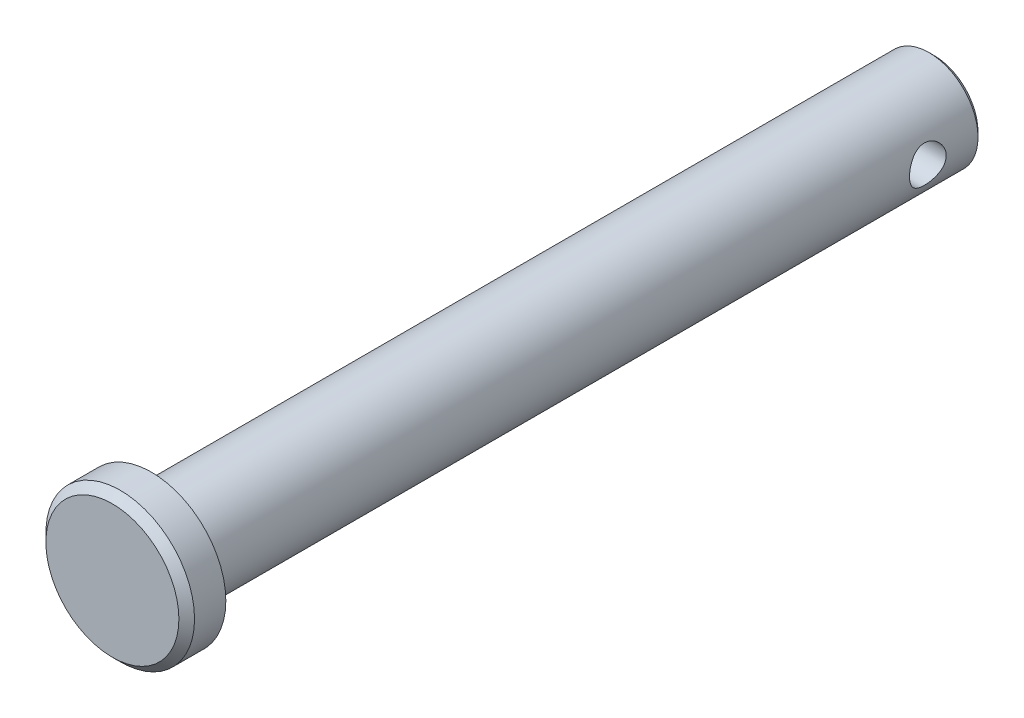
SolidWorks part; units mm, degrees
ref_plane "Front" through (0, 0, 0) normal (0, 0, 1) x (1, 0, 0)
ref_plane "Top" through (0, 0, 0) normal (0, 1, 0) x (1, 0, 0)
ref_plane "Right" through (0, 0, 0) normal (1, 0, 0) x (0, 0, -1)
sketch "Sketch1" plane through (0, 0, 0) normal (0, 0, 1) x (1, 0, 0)
  circle A0 centre (0, 0) radius 3.175
  point P3 (0, 3.175)
  point P4 (0, -3.175)
extrude "Extrude1" add sketch "Sketch1" along normal mid plane 50.8
sketch "Sketch2" plane through (0, 0, 25.4) normal (0, 0, 1) x (1, 0, 0)
  circle A0 centre (0, 0) radius 4.826
  dimension "head dia" = 9.652
extrude "Extrude2" add sketch "Sketch2" along normal blind 2.54
chamfer "Chamfer1" distance 0.508 angle 45 1 edges at (4.826, 0, 27.94)
sketch "Sketch3" plane through (0, 0, 0) normal (1, 0, 0) x (0, 0, -1)
  line L0 (-25.4, -3.175) -> (-25.4, 3.175) construction
  circle A0 centre (21.8281, 0) radius 1.1906
  point P2 (20.6375, 0)
  dimension "hole dia" = 2.3813
  dimension "useable Lg" = 46.0375
extrude "Extrude3" cut sketch "Sketch3" against normal through all and the other way through all
chamfer "Chamfer2" distance 0.3175 angle 45 1 edges at (3.175, 0, -25.4)
ref_plane "Plane1" through (0, 0, -21.8281) normal (0, 0, 1) x (1, 0, 0)
sketch "Sketch8" plane through (0, 0, 0) normal (1, 0, 0) x (0, 0, -1)
  line L0 (-27.94, 4.318) -> (-27.94, -4.318) construction
  line L1 (-27.432, -4.826) -> (-25.4, -4.826) construction
  line L2 (25.4, -2.8575) -> (25.4, 2.8575) construction
  point P0 (-27.94, 4.826)
  point P1 (-25.4, 4.826)
  point P5 (25.4, 3.175)
  point P8 (-27.94, -4.826)
  point P9 (25.4, -3.175)
equation "\"D1@Chamfer1\" = \"head ht@Extrude2\" * .2"
equation "\"D1@Chamfer2\" = \"dia@Sketch1\" * .05"
